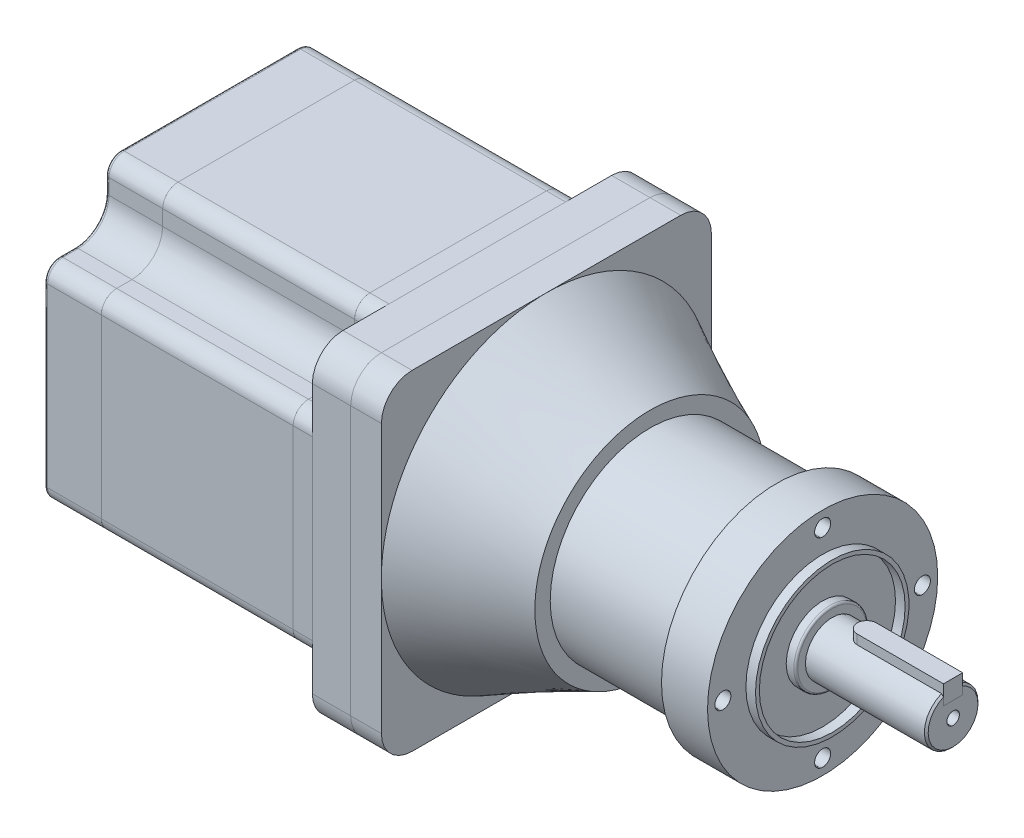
SolidWorks part; units mm, degrees
ref_plane "前视基准面" through (0, 0, 0) normal (0, 0, 1) x (1, 0, 0)
ref_plane "上视基准面" through (0, 0, 0) normal (0, 1, 0) x (1, 0, 0)
ref_plane "右视基准面" through (0, 0, 0) normal (1, 0, 0) x (0, 0, -1)
sketch "草图1" plane through (0, 0, 0) normal (1, 0, 0) x (0, 0, -1)
  line L1 (-35, -43) -> (35, -43)
  line L2 (-43, -35) -> (-43, 35)
  line L3 (-35, 43) -> (35, 43)
  line L4 (43, -35) -> (43, 35)
  line L5 (-43, -43) -> (43, 43) construction
  line L6 (-43, 43) -> (43, -43) construction
  arc A0 (-35, -43) -> (-43, -35) centre (-35, -35) cw
  arc A1 (43, -35) -> (35, -43) centre (35, -35) cw
  arc A2 (-35, 43) -> (-43, 35) centre (-35, 35) ccw
  arc A3 (35, 43) -> (43, 35) centre (35, 35) cw
  point P0 (0, 0)
  dimension "D1" = 8
extrude "凸台-拉伸1" add sketch "草图1" against normal blind 10
sketch "草图2" plane through (-10, 0, 0) normal (-1, 0, 0) x (0, 0, 1)
  line L0 (-35, 43) -> (35, 43) construction
  line L1 (-35, -43) -> (35, -43)
  line L2 (-43, -35) -> (-43, 35)
  line L3 (-35, 43) -> (35, 43)
  line L4 (43, -35) -> (43, 35)
  line L5 (-43, -43) -> (43, 43) construction
  line L6 (-43, 43) -> (43, -43) construction
  arc A0 (-43, -35) -> (-35, -43) centre (-35, -35) ccw
  arc A1 (35, -43) -> (43, -35) centre (35, -35) ccw
  arc A2 (43, 35) -> (35, 43) centre (35, 35) ccw
  arc A3 (-43, 35) -> (-35, 43) centre (-35, 35) cw
  point P0 (0, 0)
  dimension "D1" = 8
extrude "凸台-拉伸2" add sketch "草图2" along normal blind 5 separate body
sketch "草图3" plane through (-15, 0, 0) normal (-1, 0, 0) x (0, 0, 1)
  line L0 (35, 43) -> (-35, 43) construction
  line L1 (-35, -43) -> (35, -43)
  line L2 (-43, -35) -> (-43, 35)
  line L3 (-35, 43) -> (35, 43)
  line L4 (43, -35) -> (43, 35)
  line L5 (-43, -43) -> (43, 43) construction
  line L6 (-43, 43) -> (43, -43) construction
  arc A0 (-43, -35) -> (-35, -43) centre (-35, -35) ccw
  arc A1 (35, -43) -> (43, -35) centre (35, -35) ccw
  arc A2 (43, 35) -> (35, 43) centre (35, 35) ccw
  arc A3 (-43, 35) -> (-35, 43) centre (-35, 35) cw
  point P0 (0, 0)
  dimension "D1" = 8
extrude "凸台-拉伸3" add sketch "草图3" along normal blind 50 separate body
sketch "草图4" plane through (-65, 0, 0) normal (-1, 0, 0) x (0, 0, 1)
  line L0 (35, 43) -> (-35, 43) construction
  line L1 (-35, -43) -> (35, -43)
  line L2 (-43, -35) -> (-43, 35)
  line L3 (-35, 43) -> (35, 43)
  line L4 (43, -35) -> (43, 35)
  line L5 (-43, -43) -> (43, 43) construction
  line L6 (-43, 43) -> (43, -43) construction
  arc A0 (-43, -35) -> (-35, -43) centre (-35, -35) ccw
  arc A1 (35, -43) -> (43, -35) centre (35, -35) ccw
  arc A2 (43, 35) -> (35, 43) centre (35, 35) ccw
  arc A3 (-43, 35) -> (-35, 43) centre (-35, 35) cw
  point P0 (0, 0)
  dimension "D1" = 8
extrude "凸台-拉伸4" add sketch "草图4" along normal blind 15 separate body
sketch "草图5" plane through (-80, 0, 0) normal (-1, 0, 0) x (0, 0, 1)
  line L0 (-35, -27) -> (-39, -27)
  line L1 (-43, 35) -> (-43, -35) construction
  line L3 (-39, 27) -> (-35, 27)
  line L4 (-43, -35) -> (-43, -23)
  line L5 (-27, 35) -> (-27, 39)
  line L6 (35, 43) -> (-35, 43) construction
  line L8 (27, 39) -> (27, 35)
  line L9 (-35, -43) -> (-23, -43)
  line L10 (35, 27) -> (39, 27)
  line L12 (43, -35) -> (43, 35) construction
  line L13 (39, -27) -> (35, -27)
  line L14 (35, -43) -> (23, -43)
  line L15 (27, -35) -> (27, -39)
  line L16 (-35, -43) -> (35, -43) construction
  line L18 (-27, -39) -> (-27, -35)
  line L19 (43, -35) -> (43, -23)
  line L20 (43, 35) -> (43, 23)
  line L21 (35, 43) -> (23, 43)
  line L22 (-35, 43) -> (-23, 43)
  line L23 (-43, 35) -> (-43, 23)
  arc A0 (-35, 43) -> (-43, 35) centre (-35, 35) ccw
  arc A1 (27, 35) -> (35, 27) centre (35, 35) ccw
  arc A2 (35, -27) -> (27, -35) centre (35, -35) ccw
  arc A3 (-43, -35) -> (-35, -43) centre (-35, -35) ccw
  arc A4 (-39, -27) -> (-43, -23) centre (-39, -23) cw
  arc A5 (-43, 23) -> (-39, 27) centre (-39, 23) cw
  arc A6 (-23, 43) -> (-27, 39) centre (-23, 39) ccw
  arc A7 (23, 43) -> (27, 39) centre (23, 39) cw
  arc A8 (43, 23) -> (39, 27) centre (39, 23) ccw
  arc A9 (43, -23) -> (39, -27) centre (39, -23) cw
  arc A10 (27, -39) -> (23, -43) centre (23, -39) cw
  arc A11 (-27, -39) -> (-23, -43) centre (-23, -39) ccw
  arc A12 (-27, -35) -> (-35, -27) centre (-35, -35) ccw
  arc A13 (-35, 27) -> (-27, 35) centre (-35, 35) ccw
  arc A14 (43, 35) -> (35, 43) centre (35, 35) ccw
  arc A15 (35, -43) -> (43, -35) centre (35, -35) ccw
  point P38 (-43, -27)
  point P41 (-43, 27)
  point P44 (-27, 43)
  point P47 (27, 43)
  point P52 (43, -27)
  point P55 (27, -43)
  point P58 (-27, -43)
  dimension "D1" = 4
extrude "切除-拉伸1" cut sketch "草图5" against normal blind 70
sketch "草图6" plane through (0, 0, 0) normal (1, 0, 0) x (0, 0, -1)
  line L0 (43, -35) -> (43, 35) construction
  line L1 (-35, 43) -> (35, 43)
  line L2 (-43, 35) -> (-43, -35)
  line L3 (-35, -43) -> (35, -43)
  line L4 (43, 35) -> (43, -35)
  line L5 (-43, 43) -> (43, -43) construction
  line L6 (-43, -43) -> (43, 43) construction
  arc A0 (-35, 43) -> (-43, 35) centre (-35, 35) ccw
  arc A1 (-43, -35) -> (-35, -43) centre (-35, -35) ccw
  arc A2 (35, -43) -> (43, -35) centre (35, -35) ccw
  arc A3 (35, 43) -> (43, 35) centre (35, 35) cw
  point P0 (0, 0)
  dimension "D1" = 8
extrude "凸台-拉伸5" add sketch "草图6" along normal blind 8 separate body
sketch "草图7" plane through (8, 0, 0) normal (1, 0, 0) x (0, 0, -1)
  circle A0 centre (0, 0) radius 43
ref_plane "基准面1" through (35, 0, 0) normal (1, 0, 0) x (0, 0, -1)
sketch "草图8" plane through (35, 0, 0) normal (1, 0, 0) x (0, 0, -1)
  circle A0 centre (0, 0) radius 30
loft "放样1" add profiles "草图8", "草图7"
sketch "草图9" plane through (35, 0, 0) normal (1, 0, 0) x (0, 0, -1)
  circle A0 centre (0, 0) radius 26
extrude "凸台-拉伸6" add sketch "草图9" along normal blind 33 separate body
sketch "草图10" plane through (68, 0, 0) normal (1, 0, 0) x (0, 0, -1)
  circle A0 centre (0, 0) radius 30
extrude "凸台-拉伸7" add sketch "草图10" along normal blind 12 separate body
sketch "草图11" plane through (80, 0, 0) normal (1, 0, 0) x (0, 0, -1)
  circle A0 centre (0, 0) radius 20
extrude "凸台-拉伸8" add sketch "草图11" along normal blind 2.5 separate body
sketch "草图12" plane through (80, 0, 0) normal (1, 0, 0) x (0, 0, -1)
  point P7 (0, 26)
  point P8 (-26, 0)
  point P9 (0, -26)
  point P10 (26, 0)
sketch "草图17" plane through (82.5, 0, 0) normal (1, 0, 0) x (0, 0, -1)
  circle A0 centre (0, 0) radius 7
extrude "凸台-拉伸9" add sketch "草图17" along normal blind 31.5 separate body
ref_plane "基准面2" through (0, 7, 0) normal (0, 1, 0) x (1, 0, 0)
chamfer "倒角3" distance 0.5 angle 45 1 edges at (114, 0, -7)
sketch "草图21" plane through (114, 0, 0) normal (1, 0, 0) x (0, 0, -1)
  point P0 (0, 0)
hole_wizard "M4 螺纹孔1" positions "3D草图5" profile "草图22" tap size "M4" standard "GB"
sketch3d "3D草图5"
  point P0 (114, 0, 0)
sketch "草图22" plane through (114, 0, 0) normal (0, 1, 0) x (0, 0, -1)
  line L0 (0, 0) -> (0, 12.4914)
  line L1 (0, 12.4914) -> (1.65, 11.5)
  line L2 (1.65, 11.5) -> (1.65, 0)
  line L5 (1.65, 0) -> (0, 0)
  line L10 (0, 12.4914) -> (-1.65, 11.5) construction
  line L11 (0, -6.35) -> (0, 107.95) construction
  dimension "螺纹孔钻头直径" = 3.3
  dimension "螺纹孔钻头深度" = 11.5
  dimension "导头角度" = 118
sketch "草图23" plane through (-10, 0, 0) normal (-1, 0, 0) x (0, 0, 1)
  circle A0 centre (-35, 35) radius 3.9972
  circle A1 centre (35, 35) radius 4
  circle A2 centre (35, -35) radius 4
  circle A3 centre (-35, -35) radius 4
extrude "凸台-拉伸11" add sketch "草图23" along normal blind 3 separate body
chamfer "倒角4" distance 0.3 angle 45 1 edges at (-13, 35, -31.0028)
chamfer "倒角5" distance 0.3 angle 45 1 edges at (-13, -35, -31)
chamfer "倒角6" distance 0.3 angle 45 1 edges at (-13, 35, 39)
chamfer "倒角7" distance 0.3 angle 45 1 edges at (-13, -35, 39)
sketch "草图24" plane through (-13, 0, 0) normal (-1, 0, 0) x (0, 0, 1)
  line L1 (-33.701, 37.25) -> (-36.299, 37.25)
  line L2 (-36.299, 37.25) -> (-37.5981, 35)
  line L3 (-37.5981, 35) -> (-36.299, 32.75)
  line L4 (-36.299, 32.75) -> (-33.701, 32.75)
  line L5 (-33.701, 32.75) -> (-32.4019, 35)
  line L6 (-32.4019, 35) -> (-33.701, 37.25)
  line L7 (33.701, 32.75) -> (36.299, 32.75)
  line L8 (36.299, 32.75) -> (37.5981, 35)
  line L9 (37.5981, 35) -> (36.299, 37.25)
  line L10 (36.299, 37.25) -> (33.701, 37.25)
  line L11 (33.701, 37.25) -> (32.4019, 35)
  line L12 (32.4019, 35) -> (33.701, 32.75)
  line L13 (33.701, -37.25) -> (36.299, -37.25)
  line L14 (36.299, -37.25) -> (37.5981, -35)
  line L15 (37.5981, -35) -> (36.299, -32.75)
  line L16 (36.299, -32.75) -> (33.701, -32.75)
  line L17 (33.701, -32.75) -> (32.4019, -35)
  line L18 (32.4019, -35) -> (33.701, -37.25)
  line L19 (-33.701, -32.75) -> (-36.299, -32.75)
  line L20 (-36.299, -32.75) -> (-37.5981, -35)
  line L21 (-37.5981, -35) -> (-36.299, -37.25)
  line L22 (-36.299, -37.25) -> (-33.701, -37.25)
  line L23 (-33.701, -37.25) -> (-32.4019, -35)
  line L24 (-32.4019, -35) -> (-33.701, -32.75)
  circle A0 centre (-35, 35) radius 2.25 construction
  circle A1 centre (35, 35) radius 2.25 construction
  circle A2 centre (35, -35) radius 2.25 construction
  circle A3 centre (-35, -35) radius 2.25 construction
extrude "切除-拉伸3" cut sketch "草图24" against normal blind 1
chamfer "倒角8" distance 0.1 angle 45 6 edges at (-12, -37.25, -35) (-12, -36.125, -36.9486) (-13, -36.125, -33.0514) (-13, -33.875, -33.0514) (-13, -33.875, -36.9486) (-13, -32.75, -35)
chamfer "倒角9" distance 0.1 angle 45 6 edges at (-13, -33.875, 36.9486) (-13, -36.125, 36.9486) (-13, -37.25, 35) (-13, -36.125, 33.0514) (-13, -33.875, 33.0514) (-13, -32.75, 35)
chamfer "倒角10" distance 0.1 angle 45 6 edges at (-13, 37.25, 35) (-13, 36.125, 36.9486) (-13, 33.875, 36.9486) (-13, 32.75, 35) (-13, 33.875, 33.0514) (-13, 36.125, 33.0514)
chamfer "倒角11" distance 0.1 angle 45 6 edges at (-13, 33.875, -36.9486) (-13, 32.75, -35) (-13, 33.875, -33.0514) (-13, 36.125, -33.0514) (-13, 36.125, -36.9486) (-13, 37.25, -35)
sketch "草图25" plane through (82.5, 0, 0) normal (1, 0, 0) x (0, 0, -1)
  circle A0 centre (0, 0) radius 19
extrude "切除-拉伸4" cut sketch "草图25" against normal blind 2.5
sketch "草图26" plane through (80, 0, 0) normal (1, 0, 0) x (0, 0, -1)
  circle A0 centre (0, 0) radius 9.5
extrude "凸台-拉伸12" add sketch "草图26" along normal blind 2.5
fillet "圆角1" radius 0.5 1 edges at (82.5, 0, -9.5)
fillet "圆角2" radius 1 24 edges at (-80, -37, -27) (-80, -29.3431, -29.3431) (-80, -27, -37) (-80, -25.8284, -41.8284) (-80, 0, -43) (-80, 25.8284, -41.8284) (-80, 27, -37) (-80, 29.3431, -29.3431) (-80, 37, -27) (-80, 41.8284, -25.8284) (-80, 43, 0) (-80, 41.8284, 25.8284) (-80, 37, 27) (-80, 29.3431, 29.3431) (-80, 27, 37) (-80, 25.8284, 41.8284) (-80, 0, 43) (-80, -25.8284, 41.8284) (-80, -27, 37) (-80, -29.3431, 29.3431) (-80, -37, 27) (-80, -41.8284, 25.8284) (-80, -43, 0) (-80, -41.8284, -25.8284)
hole_wizard "M5 螺纹孔1" positions "3D草图7" profile "草图29" tap size "M5" standard "GB"
sketch3d "3D草图7"
  point P0 (80, 26, 0)
  point P3 (80, 0, 26)
  point P6 (80, -26, 0)
  point P9 (80, 0, -26)
sketch "草图29" plane through (80, 26, 0) normal (0, 1, 0) x (0, 0, -1)
  line L0 (0, 0) -> (0, 11.2618)
  line L1 (0, 11.2618) -> (2.1, 10)
  line L2 (2.1, 10) -> (2.1, 0)
  line L5 (2.1, 0) -> (0, 0)
  line L10 (0, 11.2618) -> (-2.1, 10) construction
  line L11 (0, -6.35) -> (0, 107.95) construction
  dimension "螺纹孔钻头直径" = 4.2
  dimension "螺纹孔钻头深度" = 10
  dimension "导头角度" = 118
sketch "草图35" plane through (0, 7, 0) normal (0, 1, 0) x (1, 0, 0)
  line L1 (114, -6.5) -> (114, 6.5) construction
  line L2 (91.5, 2.5) -> (114, 2.5)
  line L3 (114, 2.5) -> (114, -2.5)
  line L4 (114, -2.5) -> (91.5, -2.5)
  arc A0 (91.5, 2.5) -> (91.5, -2.5) centre (91.5, 0) ccw
extrude "切除-拉伸5" cut sketch "草图35" against normal blind 3
sketch "草图36" plane through (0, 4, 0) normal (0, 1, 0) x (1, 0, 0)
  line L0 (91.5, 2.5) -> (114, 2.5)
  line L1 (114, 2.5) -> (114, -2.5)
  line L2 (114, -2.5) -> (91.5, -2.5)
  arc A0 (91.5, 2.5) -> (91.5, -2.5) centre (91.5, 0) ccw
extrude "凸台-拉伸13" add sketch "草图36" along normal blind 5 separate body
